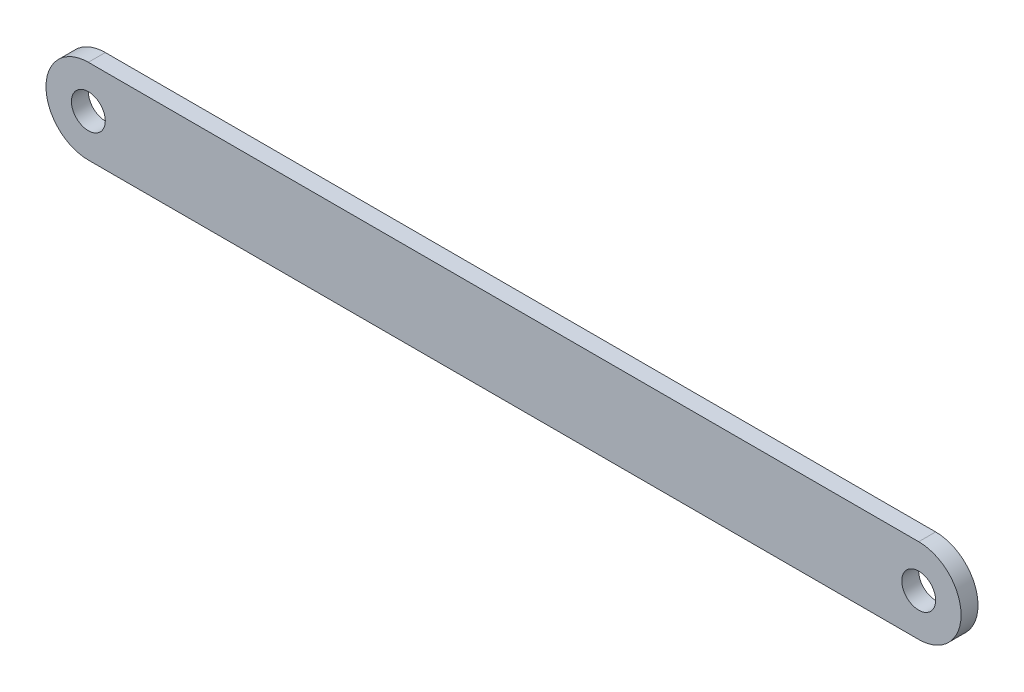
SolidWorks part; units mm, degrees
ref_plane "Front Plane" through (0, 0, 0) normal (0, 0, 1) x (1, 0, 0)
ref_plane "Top Plane" through (0, 0, 0) normal (0, 1, 0) x (1, 0, 0)
ref_plane "Right Plane" through (0, 0, 0) normal (1, 0, 0) x (0, 0, -1)
sketch "Sketch1" plane through (0, 0, 0) normal (0, 0, 1) x (1, 0, 0)
  line L0 (-122.547, 0) -> (122.547, 0) construction
  line L1 (-122.547, 12.5) -> (122.547, 12.5)
  line L2 (-122.547, -12.5) -> (122.547, -12.5)
  arc A0 (-122.547, 12.5) -> (-122.547, -12.5) centre (-122.547, 0) ccw
  arc A1 (122.547, -12.5) -> (122.547, 12.5) centre (122.547, 0) ccw
  point P2 (0, 0)
  dimension "D1" = 245.094
  dimension "D2" = 25
extrude "Boss-Extrude1" add sketch "Sketch1" along normal blind 5 contours A0 L2 A1 L1
hole_wizard "M8 Clearance Hole2" positions "Sketch2" profile "Sketch3" hole size "M8" standard "ANSI Metric"
sketch "Sketch2" plane through (0, 0, 5) normal (0, 0, 1) x (1, 0, 0)
  point P0 (-122.547, 0)
sketch "Sketch3" plane through (-122.547, 0, 5) normal (1, 0, 0) x (0, -1, 0)
  line L0 (0, 0) -> (0, 5)
  line L1 (0, 5) -> (5, 5)
  line L2 (5, 5) -> (5, 0)
  line L5 (5, 0) -> (0, 0)
  line L11 (0, -6.35) -> (0, 107.95) construction
  dimension "Thru Hole Dia." = 10
  dimension "Thru Hole Depth" = 5
hole_wizard "M8 Clearance Hole1" positions "Sketch4" profile "Sketch6" hole size "M8" standard "ANSI Metric"
sketch "Sketch4" plane through (0, 0, 5) normal (0, 0, 1) x (1, 0, 0)
  point P0 (122.547, 0)
sketch "Sketch6" plane through (122.547, 0, 5) normal (1, 0, 0) x (0, -1, 0)
  line L0 (0, 0) -> (0, 5)
  line L1 (0, 5) -> (5, 5)
  line L2 (5, 5) -> (5, 0)
  line L5 (5, 0) -> (0, 0)
  line L11 (0, -6.35) -> (0, 107.95) construction
  dimension "Thru Hole Dia." = 10
  dimension "Thru Hole Depth" = 5
